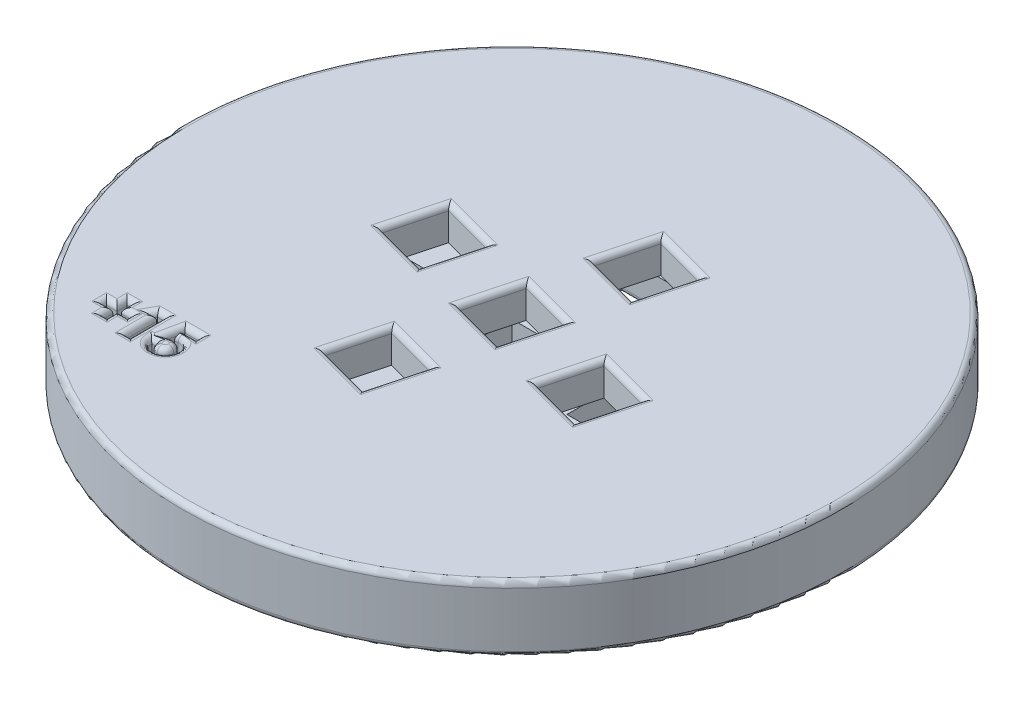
SolidWorks part; units mm, degrees
ref_plane "Front Plane" through (0, 0, 0) normal (0, 0, 1) x (1, 0, 0)
ref_plane "Top Plane" through (0, 0, 0) normal (0, 1, 0) x (1, 0, 0)
ref_plane "Right Plane" through (0, 0, 0) normal (1, 0, 0) x (0, 0, -1)
sketch "Sketch1" plane through (0, 0, 0) normal (0, 1, 0) x (1, 0, 0)
  circle A0 centre (0, 0) radius 30
extrude "Boss-Extrude1" add sketch "Sketch1" along normal blind 6
sketch "Sketch2" plane through (0, 6, 0) normal (0, 1, 0) x (1, 0, 0)
  line L0 (0, 0) -> (0, -10) construction
  line L1 (0, 0) -> (10, 0) construction
  line L2 (0, 0) -> (-10, 0) construction
  line L3 (0, 0) -> (0, 10) construction
  line L5 (-2.5, -7.5) -> (2.5, -7.5)
  line L6 (-2.5, -7.5) -> (-2.5, -12.5)
  line L7 (-2.5, -12.5) -> (2.5, -12.5)
  line L8 (2.5, -7.5) -> (2.5, -12.5)
  line L9 (-2.5, -7.5) -> (2.5, -12.5) construction
  line L10 (-2.5, -12.5) -> (2.5, -7.5) construction
  line L11 (-7.5, -2.5) -> (-12.5, -2.5)
  line L12 (-7.5, -2.5) -> (-7.5, 2.5)
  line L13 (-7.5, 2.5) -> (-12.5, 2.5)
  line L14 (-12.5, -2.5) -> (-12.5, 2.5)
  line L15 (-7.5, -2.5) -> (-12.5, 2.5) construction
  line L16 (-7.5, 2.5) -> (-12.5, -2.5) construction
  line L17 (2.5, -2.5) -> (-2.5, -2.5)
  line L18 (2.5, -2.5) -> (2.5, 2.5)
  line L19 (2.5, 2.5) -> (-2.5, 2.5)
  line L20 (-2.5, -2.5) -> (-2.5, 2.5)
  line L21 (2.5, -2.5) -> (-2.5, 2.5) construction
  line L22 (2.5, 2.5) -> (-2.5, -2.5) construction
  line L23 (-2.5, 12.5) -> (2.5, 12.5)
  line L24 (-2.5, 12.5) -> (-2.5, 7.5)
  line L25 (-2.5, 7.5) -> (2.5, 7.5)
  line L26 (2.5, 12.5) -> (2.5, 7.5)
  line L27 (-2.5, 12.5) -> (2.5, 7.5) construction
  line L28 (-2.5, 7.5) -> (2.5, 12.5) construction
  line L29 (12.5, -2.5) -> (7.5, -2.5)
  line L30 (12.5, -2.5) -> (12.5, 2.5)
  line L31 (12.5, 2.5) -> (7.5, 2.5)
  line L32 (7.5, -2.5) -> (7.5, 2.5)
  line L33 (12.5, -2.5) -> (7.5, 2.5) construction
  line L34 (12.5, 2.5) -> (7.5, -2.5) construction
  dimension "D1" = 5
  dimension "D2" = 10
  dimension "D3" = 5
  dimension "D4" = 5
  dimension "D5" = 5
  dimension "D6" = 5
  dimension "D7" = 5
  dimension "D8" = 5
sketch "Sketch3" plane through (0, 6, 0) normal (0, 1, 0) x (1, 0, 0)
sketch "Sketch4" plane through (0, 0, 0) normal (0, -1, 0) x (-1, 0, 0)
  line L0 (0, 0) -> (-10, 0) construction
  line L1 (0, 0) -> (0, -10) construction
  line L2 (0, 0) -> (0, 10) construction
  line L3 (0, 0) -> (10, 0) construction
  line L5 (-2.5, 2.5) -> (2.5, 2.5)
  line L6 (-2.5, 2.5) -> (-2.5, -2.5)
  line L7 (-2.5, -2.5) -> (2.5, -2.5)
  line L8 (2.5, 2.5) -> (2.5, -2.5)
  line L9 (-2.5, 2.5) -> (2.5, -2.5) construction
  line L10 (-2.5, -2.5) -> (2.5, 2.5) construction
  line L11 (-2.5, -7.5) -> (2.5, -7.5)
  line L12 (-2.5, -7.5) -> (-2.5, -12.5)
  line L13 (-2.5, -12.5) -> (2.5, -12.5)
  line L14 (2.5, -7.5) -> (2.5, -12.5)
  line L15 (-2.5, -7.5) -> (2.5, -12.5) construction
  line L16 (-2.5, -12.5) -> (2.5, -7.5) construction
  line L17 (7.5, 2.5) -> (12.5, 2.5)
  line L18 (7.5, 2.5) -> (7.5, -2.5)
  line L19 (7.5, -2.5) -> (12.5, -2.5)
  line L20 (12.5, 2.5) -> (12.5, -2.5)
  line L21 (7.5, 2.5) -> (12.5, -2.5) construction
  line L22 (7.5, -2.5) -> (12.5, 2.5) construction
  line L23 (-12.5, 2.5) -> (-7.5, 2.5)
  line L24 (-12.5, 2.5) -> (-12.5, -2.5)
  line L25 (-12.5, -2.5) -> (-7.5, -2.5)
  line L26 (-7.5, 2.5) -> (-7.5, -2.5)
  line L27 (-12.5, 2.5) -> (-7.5, -2.5) construction
  line L28 (-12.5, -2.5) -> (-7.5, 2.5) construction
  line L29 (2.5, 7.5) -> (-2.5, 7.5)
  line L30 (2.5, 7.5) -> (2.5, 12.5)
  line L31 (2.5, 12.5) -> (-2.5, 12.5)
  line L32 (-2.5, 7.5) -> (-2.5, 12.5)
  line L33 (2.5, 7.5) -> (-2.5, 12.5) construction
  line L34 (2.5, 12.5) -> (-2.5, 7.5) construction
  dimension "D1" = 5
  dimension "D2" = 5
  dimension "D3" = 5
  dimension "D4" = 5
  dimension "D5" = 5
  dimension "D6" = 5
extrude "Cut-Extrude2" cut sketch "Sketch4" against normal blind 3
fillet "Fillet2" radius 0.5 21 edges at (0, 0, 30) (2.5, 0, 0) (0, 0, 2.5) (-2.5, 0, 0) (0, 0, -2.5) (2.5, 0, 10) (0, 0, 12.5) (-2.5, 0, 10) (0, 0, 7.5) (-7.5, 0, 0) (-10, 0, 2.5) (-12.5, 0, 0) (-10, 0, -2.5) (12.5, 0, 0) (10, 0, 2.5) (7.5, 0, 0) (10, 0, -2.5) (-2.5, 0, -10) (0, 0, -12.5) (2.5, 0, -10) (0, 0, -7.5)
fillet "Fillet3" radius 0.5 1 edges at (0, 6, 30)
sketch "Sketch5" plane through (0, 6, 0) normal (0, 1, 0) x (1, 0, 0)
sketch "Sketch6" plane through (0, 6, 0) normal (0, 1, 0) x (1, 0, 0)
  line L0 (0, -30) -> (0, 30) construction
  line L1 (0, 0) -> (7.7646, 28.9778) construction
  line L2 (-3.0619, -1.7678) -> (1.7678, -3.0619)
  line L3 (-3.0619, -1.7678) -> (-1.7678, 3.0619)
  line L4 (1.7678, -3.0619) -> (3.0619, 1.7678)
  line L5 (-1.7678, 3.0619) -> (3.0619, 1.7678)
  line L6 (-3.0619, -1.7678) -> (3.0619, 1.7678) construction
  line L7 (1.7678, -3.0619) -> (-1.7678, 3.0619) construction
  line L8 (-0.4737, 7.8915) -> (4.356, 6.5974)
  line L9 (-0.4737, 7.8915) -> (0.8204, 12.7211)
  line L10 (4.356, 6.5974) -> (5.6501, 11.427)
  line L11 (0.8204, 12.7211) -> (5.6501, 11.427)
  line L12 (-0.4737, 7.8915) -> (5.6501, 11.427) construction
  line L13 (4.356, 6.5974) -> (0.8204, 12.7211) construction
  line L14 (0, 0) -> (-7.6352, -28.4948) construction
  line L15 (-0.8204, -12.7211) -> (-5.6501, -11.427)
  line L16 (-0.8204, -12.7211) -> (0.4737, -7.8915)
  line L17 (-5.6501, -11.427) -> (-4.356, -6.5974)
  line L18 (0.4737, -7.8915) -> (-4.356, -6.5974)
  line L19 (-0.8204, -12.7211) -> (-4.356, -6.5974) construction
  line L20 (-5.6501, -11.427) -> (0.4737, -7.8915) construction
  line L21 (0, 0) -> (-28.4948, 7.6352) construction
  line L22 (0, 0) -> (28.4948, -7.6352) construction
  line L23 (11.427, -5.6501) -> (6.5974, -4.356)
  line L24 (11.427, -5.6501) -> (12.7211, -0.8204)
  line L25 (6.5974, -4.356) -> (7.8915, 0.4737)
  line L26 (12.7211, -0.8204) -> (7.8915, 0.4737)
  line L27 (11.427, -5.6501) -> (7.8915, 0.4737) construction
  line L28 (6.5974, -4.356) -> (12.7211, -0.8204) construction
  line L29 (-12.7211, 0.8204) -> (-7.8915, -0.4737)
  line L30 (-12.7211, 0.8204) -> (-11.427, 5.6501)
  line L31 (-7.8915, -0.4737) -> (-6.5974, 4.356)
  line L32 (-11.427, 5.6501) -> (-6.5974, 4.356)
  line L33 (-12.7211, 0.8204) -> (-6.5974, 4.356) construction
  line L34 (-7.8915, -0.4737) -> (-11.427, 5.6501) construction
  line L35 (-19.7925, -19.1465) -> (-12.6703, -19.1465) construction
  circle A0 centre (0, 0) radius 30 construction
  circle A1 centre (0, 0) radius 29.5 construction
  text T0 "<b>+15</b>"
  point P8 (2.5882, 9.6593)
  point P21 (-2.5882, -9.6593)
  point P23 (9.6593, -2.5882)
  point P28 (-9.6593, 2.5882)
  dimension "D1" = 15
  dimension "D2" = 5
  dimension "D3" = 5
  dimension "D4" = 10
  dimension "D5" = 5
  dimension "D6" = 5
  dimension "D7" = 15
  dimension "D8" = 5
  dimension "D9" = 5
  dimension "D10" = 90
  dimension "D11" = 90
  dimension "D12" = 10
  dimension "D13" = 5
  dimension "D14" = 5
  dimension "D15" = 180
  dimension "D16" = 5
  dimension "D17" = 5
  dimension "D18" = 180
  dimension "D19" = 10
  dimension "D20" = 10
extrude "Cut-Extrude3" cut sketch "Sketch6" against normal blind 3
fillet "Fillet4" radius 0.5 50 edges at (-12.9464, 6, 16.3378) (-12.4248, 6, 16.1547) (-16.393, 6, 16.1547) (-16.2511, 6, 16.3378) (-15.5998, 6, 17.559) (-15.9452, 6, 15.9715) (-14.2613, 6, 18.3324) (-19.0801, 6, 17.7218) (-18.612, 6, 18.1899) (-18.4085, 6, 18.658) (-18.205, 6, 18.1899) (-17.7369, 6, 17.7218) (-17.2687, 6, 17.5386) (-17.7369, 6, 17.3555) (-18.205, 6, 16.8873) (-18.4085, 6, 16.4192) (-18.612, 6, 16.8873) (-19.0801, 6, 17.3555) (-19.5482, 6, 17.5386) (-0.647, 6, 2.4148) (2.4148, 6, 0.647) (0.647, 6, -2.4148) (-2.4148, 6, -0.647) (1.9411, 6, -7.2444) (5.003, 6, -9.0122) (3.2352, 6, -12.0741) (0.1734, 6, -10.3063) (-1.9411, 6, 7.2444) (-5.003, 6, 9.0122) (-3.2352, 6, 12.0741) (-0.1734, 6, 10.3063) (10.3063, 6, 0.1734) (7.2444, 6, 1.9411) (9.0122, 6, 5.003) (12.0741, 6, 3.2352) (-10.3063, 6, -0.1734) (-7.2444, 6, -1.9411) (-9.0122, 6, -5.003) (-12.0741, 6, -3.2352) (-16.0069, 6, 17.7422) (-15.8034, 6, 19.1465) (-13.113, 6, 15.9715) (-13.9678, 6, 16.7652)
